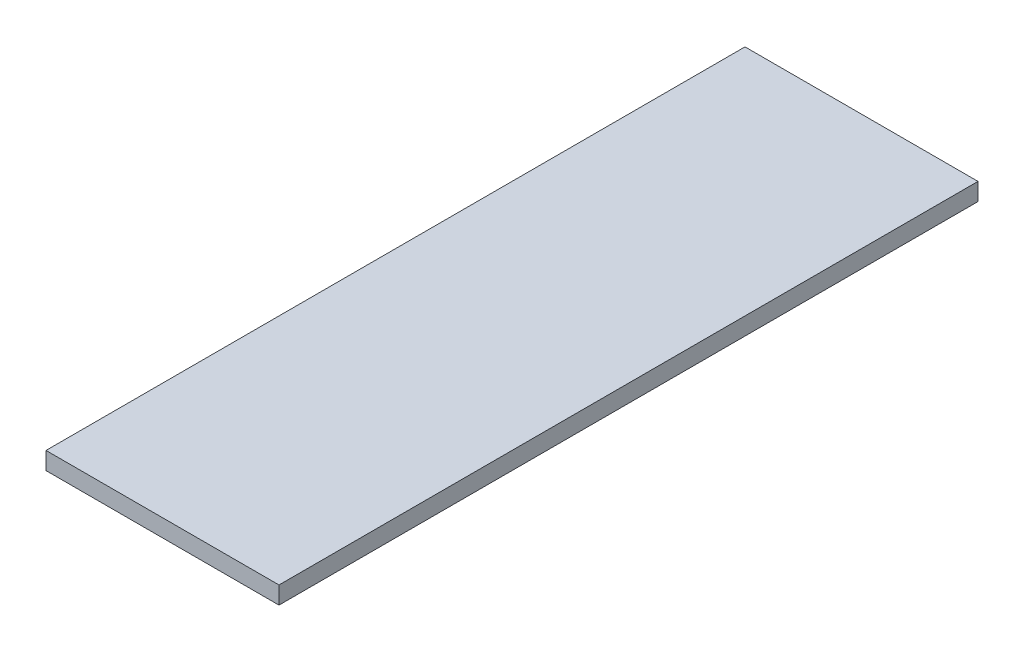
SolidWorks part; units mm, degrees
ref_plane "Plan de face" through (0, 0, 0) normal (0, 0, 1) x (1, 0, 0)
ref_plane "Plan de dessus" through (0, 0, 0) normal (0, 1, 0) x (1, 0, 0)
ref_plane "Plan de droite" through (0, 0, 0) normal (1, 0, 0) x (0, 0, -1)
sketch "Esquisse1" plane through (0, 0, 0) normal (0, 0, 1) x (1, 0, 0)
  line L1 (-20, 92) -> (20, 92)
  line L2 (-20, 92) -> (-20, 95)
  line L3 (-20, 95) -> (20, 95)
  line L4 (20, 92) -> (20, 95)
extrude "Boss.-Extru.1" add sketch "Esquisse1" along normal up to surface (10 mm away) and the other way up to surface (110 mm away)
